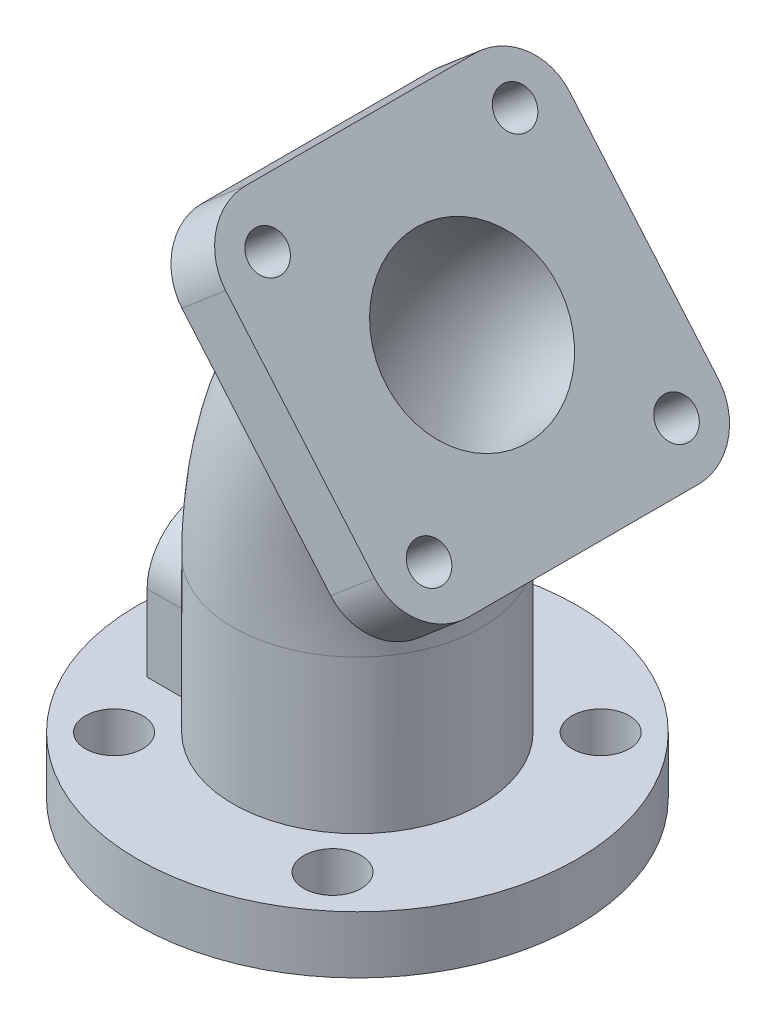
SolidWorks part; units mm, degrees
ref_plane "前视基准面" through (0, 0, 0) normal (0, 0, 1) x (1, 0, 0)
ref_plane "上视基准面" through (0, 0, 0) normal (0, 1, 0) x (1, 0, 0)
ref_plane "右视基准面" through (0, 0, 0) normal (1, 0, 0) x (0, 0, -1)
sketch "草图1" plane through (0, 0, 0) normal (0, 1, 0) x (1, 0, 0)
  circle A0 centre (0, 0) radius 13
  circle A1 centre (0, 0) radius 9
sketch "草图4" plane through (0, 0, 0) normal (0, 0, 1) x (1, 0, 0)
  line L0 (0, 0) -> (0, 22)
  arc A0 (0, 22) -> (12, 48) centre (34.1667, 22) cw
  point P3 (12, 48)
sweep "扫描1" add profiles "草图1" path "草图4"
sketch "草图5" plane through (0, 0, 0) normal (0, 1, 0) x (1, 0, 0)
  circle A0 centre (0, 0) radius 23
  circle A1 centre (0, 0) radius 13
extrude "拉伸2" add sketch "草图5" along normal blind 6
sketch "草图6" plane through (30.6469, 26.1284, 0) normal (0.761, 0.6488, 0) x (0, 0, -1)
  line L1 (-12, 46.74) -> (12, 46.74)
  line L2 (-18, 40.74) -> (-18, 16.74)
  line L3 (-12, 10.74) -> (12, 10.74)
  line L4 (18, 40.74) -> (18, 16.74)
  arc A0 (18, 40.74) -> (12, 46.74) centre (12, 40.74) ccw
  circle A5 centre (0, 28.7415) radius 12
  arc A6 (12, 10.74) -> (18, 16.74) centre (12, 16.74) ccw
  arc A7 (-18, 40.74) -> (-12, 46.74) centre (-12, 40.74) cw
  arc A8 (-12, 10.74) -> (-18, 16.74) centre (-12, 16.74) cw
  point P0 (0, 28.7415)
  point P2 (0, 0)
  dimension "D1" = 28.7415
  dimension "D3" = 6
extrude "拉伸3" add sketch "草图6" against normal blind 6
sketch "草图9" plane through (30.6469, 26.1284, 0) normal (0.761, 0.6488, 0) x (0, 0, -1)
  circle A0 centre (12.9332, 41.7415) radius 2
  circle A1 centre (-13, 41.6746) radius 2
  circle A2 centre (-12.9332, 15.7415) radius 2
  circle A3 centre (13, 15.8083) radius 2
extrude "切除-拉伸1" cut sketch "草图9" against normal up to next
ref_plane "基准面1" through (-16, 0, 0) normal (1, 0, 0) x (0, 0, -1)
sketch "草图10" plane through (-16, 0, 0) normal (1, 0, 0) x (0, 0, -1)
  line L1 (23, 6) -> (-23, 6) construction
  line L2 (-6, 6) -> (-6, 14)
  line L3 (6, 14) -> (6, 6)
  line L4 (6, 6) -> (-6, 6)
  arc A0 (-6, 14) -> (6, 14) centre (0, 14) cw
extrude "拉伸4" add sketch "草图10" along normal up to next
sketch "草图11" plane through (-16, 0, 0) normal (-1, 0, 0) x (0, 0, 1)
  circle A0 centre (0, 14) radius 3
extrude "切除-拉伸2" cut sketch "草图11" against normal up to next
sketch "草图12" plane through (0, 6, 0) normal (0, 1, 0) x (1, 0, 0)
  line L1 (23.7203, 23.7203) -> (-26.3215, -26.3215) construction
  line L3 (-28.5691, 25.9679) -> (25.0613, -27.6625) construction
  circle A0 centre (0, 0) radius 18 construction
  circle A1 centre (12.7279, 12.7279) radius 3
  circle A2 centre (-13.9619, 11.3607) radius 3
  circle A3 centre (-12.7279, -12.7279) radius 3
  circle A4 centre (11.3607, -13.9619) radius 3
extrude "切除-拉伸3" cut sketch "草图12" against normal through all
